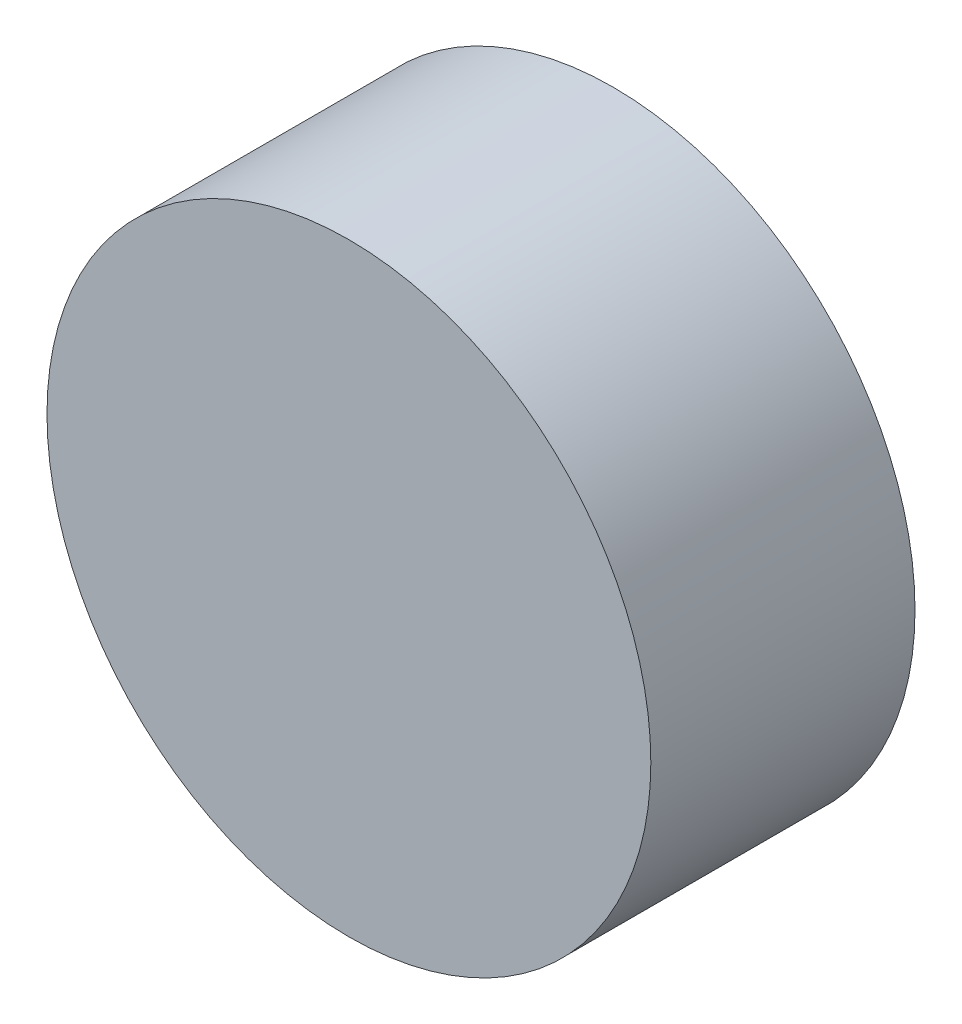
SolidWorks part; units mm, degrees
ref_plane "前视基准面" through (0, 0, 0) normal (0, 0, 1) x (1, 0, 0)
ref_plane "上视基准面" through (0, 0, 0) normal (0, 1, 0) x (1, 0, 0)
ref_plane "右视基准面" through (0, 0, 0) normal (1, 0, 0) x (0, 0, -1)
other "Configuration Table"
sketch "草图1" plane through (0, 0, 0) normal (0, 0, 1) x (1, 0, 0)
  circle A0 centre (0, 0) radius 4
  dimension "D1" = 8
extrude "凸台-拉伸1" add sketch "草图1" along normal blind 3.5
